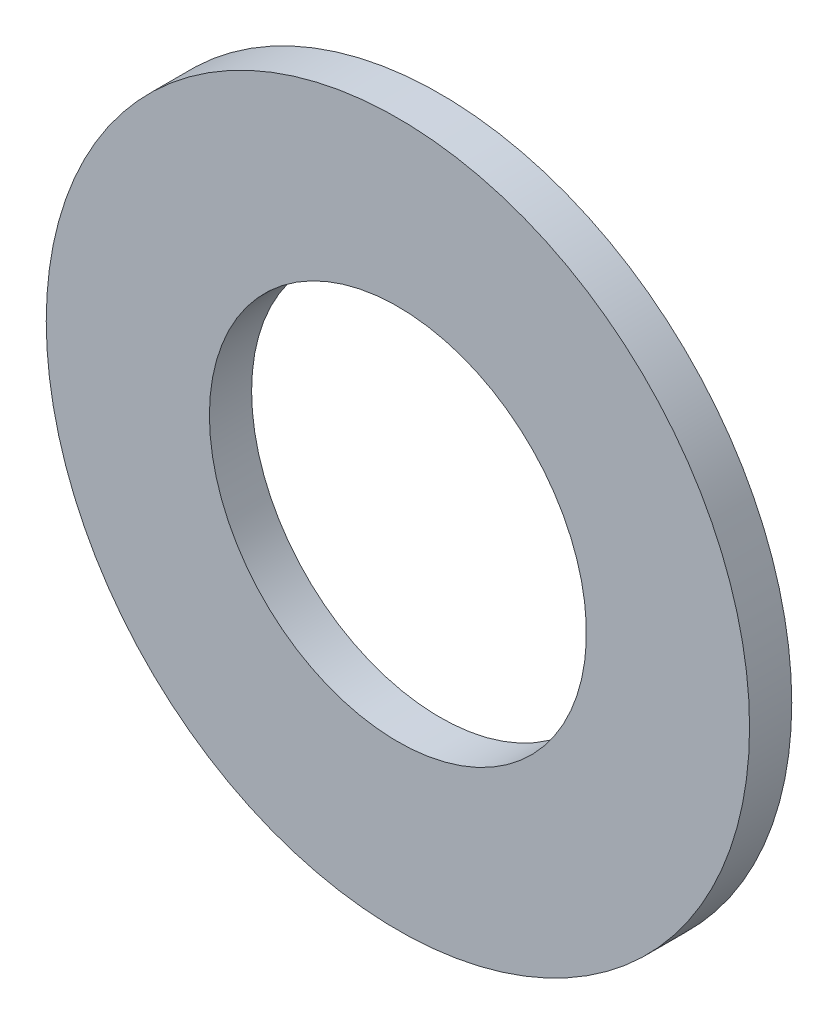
SolidWorks part; units mm, degrees
ref_plane "Front Plane" through (0, 0, 0) normal (0, 0, 1) x (1, 0, 0)
ref_plane "Top Plane" through (0, 0, 0) normal (0, 1, 0) x (1, 0, 0)
ref_plane "Right Plane" through (0, 0, 0) normal (1, 0, 0) x (0, 0, -1)
sketch "Sketch1" plane through (0, 0, 0) normal (0, 0, 1) x (1, 0, 0)
  circle A0 centre (0, 0) radius 3.4036
  circle A1 centre (0, 0) radius 6.35
  dimension "D1" = 6.8072
  dimension "D2" = 12.7
extrude "Boss-Extrude1" add sketch "Sketch1" along normal blind 0.762
